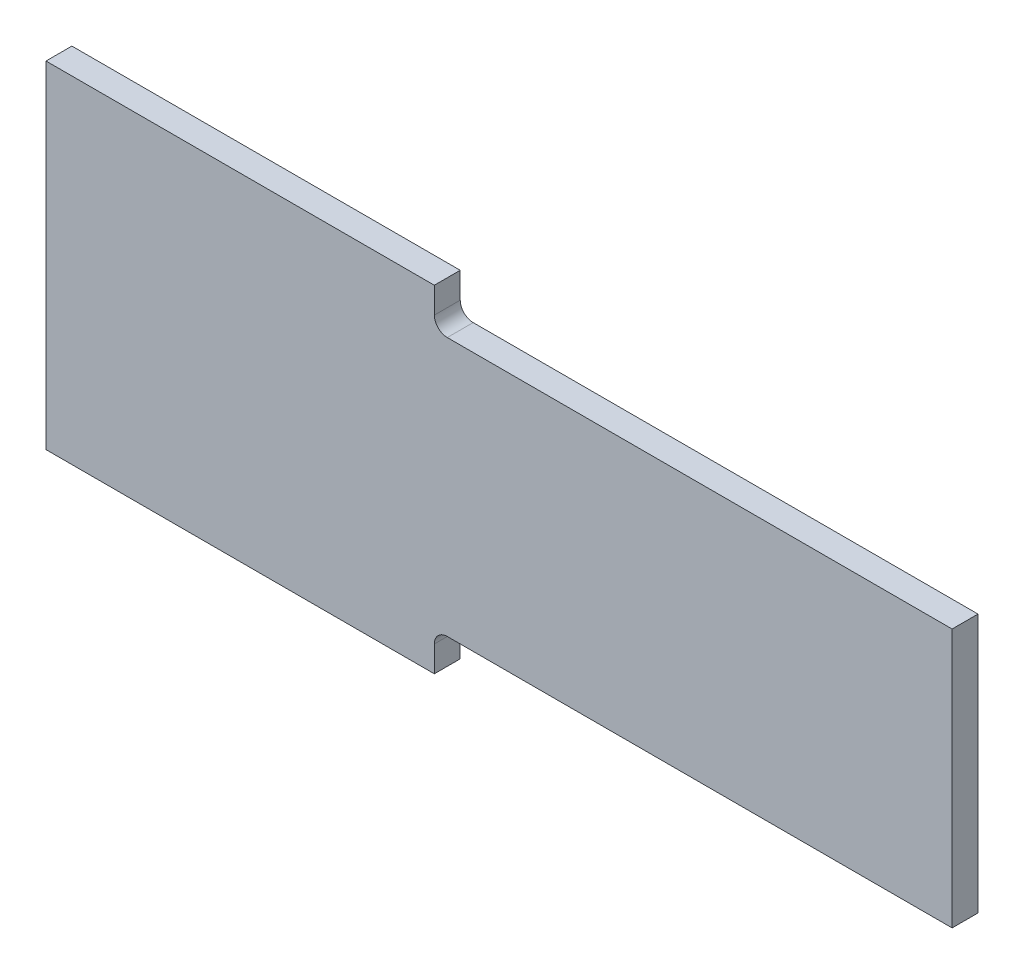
SolidWorks part; units mm, degrees
ref_plane "Front Plane" through (0, 0, 0) normal (0, 0, 1) x (1, 0, 0)
ref_plane "Top Plane" through (0, 0, 0) normal (0, 1, 0) x (1, 0, 0)
ref_plane "Right Plane" through (0, 0, 0) normal (1, 0, 0) x (0, 0, -1)
sketch "Sketch2" plane through (0, 0, 0) normal (0, 0, 1) x (1, 0, 0)
  line L0 (0, -6.5) -> (0, 6.5)
  line L1 (0, -7.15) -> (0, 7.15) construction
  line L3 (0, 6.5) -> (15, 6.5)
  line L4 (0, -6.5) -> (15, -6.5)
  line L5 (15, 6.5) -> (15, 5.5)
  line L6 (15, -6.5) -> (15, -5.5)
  line L7 (15.5, 5) -> (35, 5)
  line L8 (15.5, -5) -> (35, -5)
  line L9 (35, -5) -> (35, 5)
  arc A0 (15.5, 5) -> (15, 5.5) centre (15.5, 5.5) cw
  arc A1 (15.5, -5) -> (15, -5.5) centre (15.5, -5.5) ccw
  point P13 (15, 5)
  point P16 (15, -5)
  dimension "D8" = 0.5
  dimension "D9" = 0.5
  dimension "D1" = 13
  dimension "D2" = 6.5
  dimension "D3" = 15
  dimension "D4" = 15
  dimension "D5" = 1.5
  dimension "D6" = 1.5
  dimension "D7" = 20
extrude "Boss-Extrude1" add sketch "Sketch2" along normal blind 1
